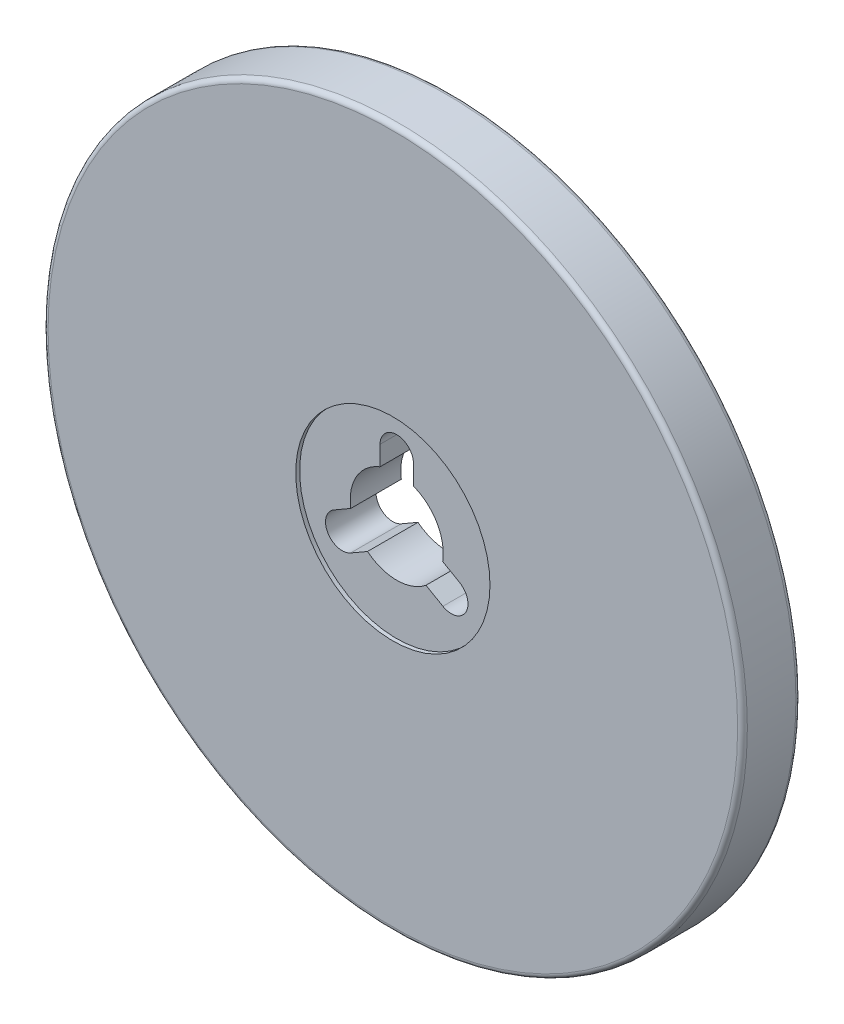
SolidWorks part; units mm, degrees
ref_plane "Front Plane" through (0, 0, 0) normal (0, 0, 1) x (1, 0, 0)
ref_plane "Top Plane" through (0, 0, 0) normal (0, 1, 0) x (1, 0, 0)
ref_plane "Right Plane" through (0, 0, 0) normal (1, 0, 0) x (0, 0, -1)
sketch "Sketch1" plane through (0, 0, 0) normal (0, 0, 1) x (1, 0, 0)
  circle A0 centre (0, 0) radius 228.6
  dimension "D1" = 457.2
extrude "Extrude1" add sketch "Sketch1" along normal mid plane 38.1
sketch "Sketch2" plane through (0, 0, 19.05) normal (0, 0, 1) x (1, 0, 0)
  circle A0 centre (0, 0) radius 30.4165
  dimension "D1" = 60.833
extrude "Cut-Extrude1" cut sketch "Sketch2" against normal through all
sketch "Sketch3" plane through (0, 0, 19.05) normal (0, 0, 1) x (1, 0, 0)
  line L0 (10.922, 41.148) -> (10.922, 28.3879)
  line L1 (-10.922, 41.148) -> (-10.922, 28.3879)
  arc A0 (10.922, 41.148) -> (-10.922, 41.148) centre (0, 41.148) ccw
  circle A1 centre (0, 0) radius 30.4165 construction
  dimension "D1" = 21.844
  dimension "D2" = 41.148
extrude "Cut-Extrude2" cut sketch "Sketch3" against normal through all and the other way through all
pattern_circular "CirPattern1" count 3 every 120 about axis through (0, 0, -19.05) along (0, 0, 1) of "Cut-Extrude2"
fillet "Fillet1" radius 3.175 1 edges at (228.6, 0, 19.05)
fillet "Fillet2" radius 3.175 1 edges at (228.6, 0, -19.05)
sketch "Sketch4" plane through (0, 0, 19.05) normal (0, 0, 1) x (1, 0, 0)
  circle A0 centre (0, 0) radius 63.5
  dimension "D1" = 127
extrude "Cut-Extrude3" cut sketch "Sketch4" against normal blind 2.54
mirror "Mirror1" about plane through (0, 0, 0) normal (0, 0, 1) of "Cut-Extrude3"
sketch "Sketch5" plane through (0, 0, -19.05) normal (0, 0, -1) x (-1, 0, 0)
  circle A0 centre (0, 152.4) radius 50.8
  dimension "D1" = 101.6
  dimension "D2" = 152.4
extrude "Cut-Extrude4" [suppressed] cut sketch "Sketch5" against normal through all
pattern_circular "CirPattern2" [suppressed] count 6 every 60
